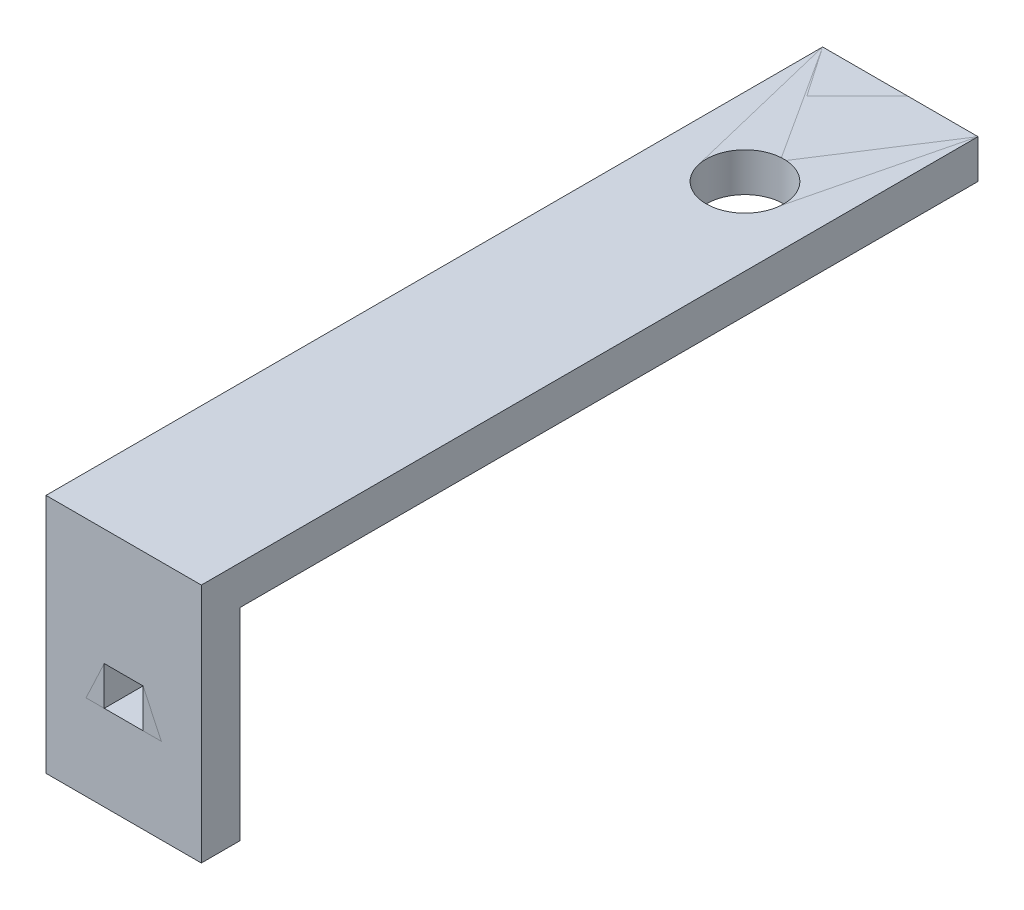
SolidWorks part; units mm, degrees
ref_plane "Front" through (0, 0, 0) normal (0, 0, 1) x (1, 0, 0)
ref_plane "Top" through (0, 0, 0) normal (0, 1, 0) x (1, 0, 0)
ref_plane "Right" through (0, 0, 0) normal (1, 0, 0) x (0, 0, -1)
imported_body "Imported1"
sketch "Sketch1" plane through (0, 0, 29.1608) normal (0, 0, 1) x (1, 0, 0)
  line L0 (-10, -6.6918) -> (-10, -17.6911)
  line L1 (-10, -17.6911) -> (10, -17.6911)
  line L2 (10, -17.6911) -> (10, -6.6918)
  line L3 (10, -6.6918) -> (-10, -6.6918)
extrude "Extrude1" add sketch "Sketch1" against normal up to surface
